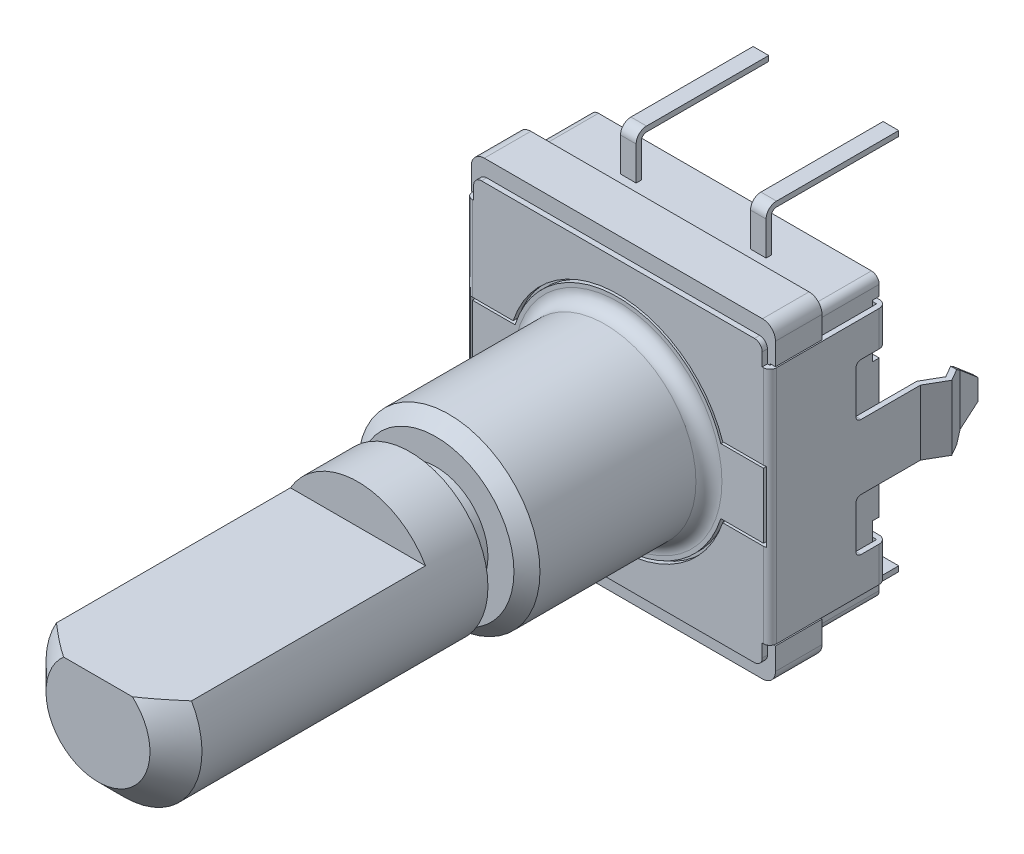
SolidWorks part; units mm, degrees
other "____________2[1]"
other "________-____________4[1][1]"
other "____________1[1]"
other "____________1[2]"
other "____________2[2]"
ref_plane "前视基准面" through (0, 0, 0) normal (0, 0, 1) x (1, 0, 0)
ref_plane "上视基准面" through (0, 0, 0) normal (0, 1, 0) x (1, 0, 0)
ref_plane "右视基准面" through (0, 0, 0) normal (1, 0, 0) x (0, 0, -1)
other "Configuration Table"
imported_body "输入1"
imported_body "输入2"
imported_body "输入3"
imported_body "输入4"
imported_body "输入5"
sketch "草图1" plane through (0, 0, 0) normal (0, 0, -1) x (-1, 0, 0)
  line L3 (-0.3912, 0.2593) -> (0.513, 0.2593)
  line L4 (-0.3912, 0.2593) -> (-0.3912, -0.0564)
  line L5 (-0.3912, -0.0564) -> (0.513, -0.0564)
  line L6 (0.513, 0.2593) -> (0.513, -0.0564)
extrude "切除-拉伸1" cut sketch "草图1" against normal blind 0.5
